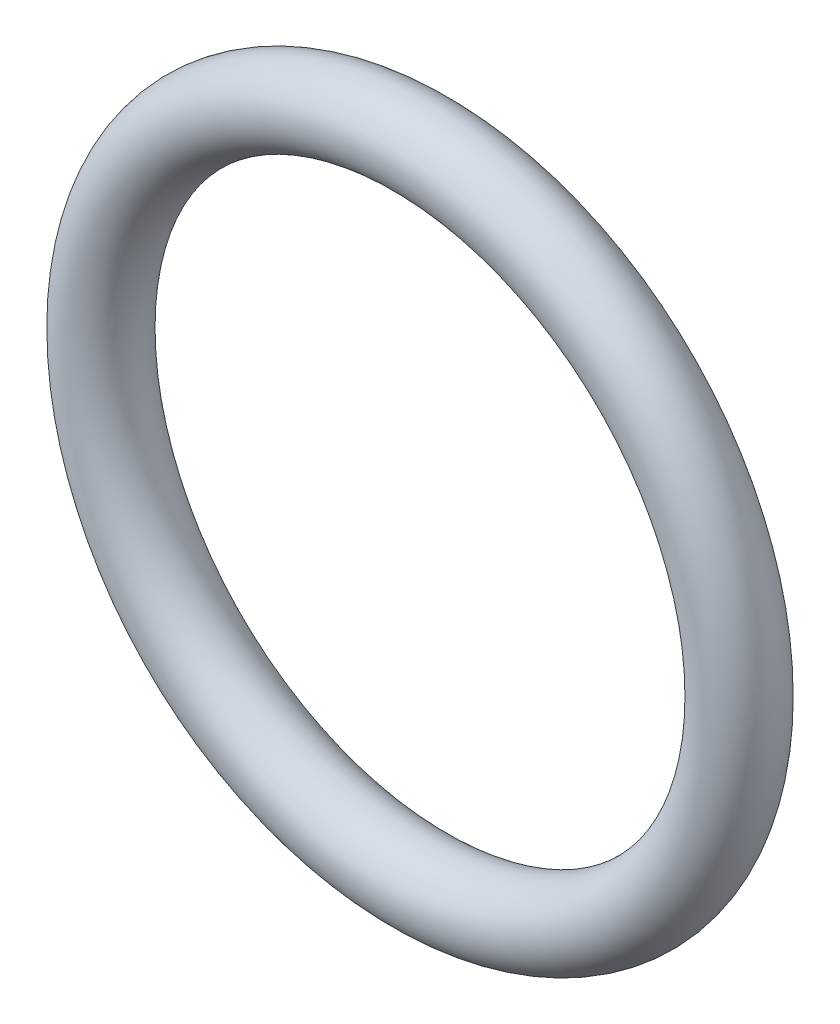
SolidWorks part; units mm, degrees
ref_plane "前视基准面" through (0, 0, 0) normal (0, 0, 1) x (1, 0, 0)
ref_plane "上视基准面" through (0, 0, 0) normal (0, 1, 0) x (1, 0, 0)
ref_plane "右视基准面" through (0, 0, 0) normal (1, 0, 0) x (0, 0, -1)
sketch "草图1" plane through (0, 0, 0) normal (0, 0, 1) x (1, 0, 0)
  circle A0 centre (0, 0) radius 12.5
  dimension "D1" = 25
sweep "扫描1" add path "草图1" parameters "D3"=3
sketch "草图" plane through (0, 0, 0) normal (0, 0, 1) x (1, 0, 0)
  circle A0 centre (0, 0) radius 12.5
  dimension "D1" = 25
